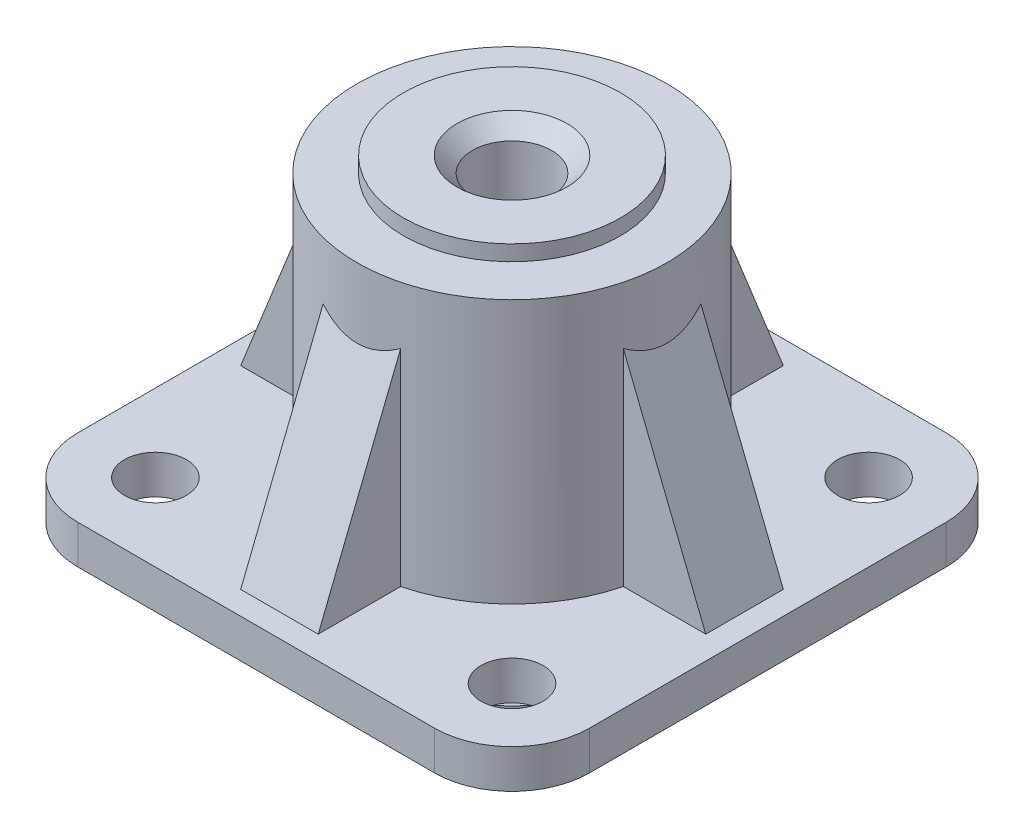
SolidWorks part; units mm, degrees
ref_plane "Front Plane" through (0, 0, 0) normal (0, 0, 1) x (1, 0, 0)
ref_plane "Top Plane" through (0, 0, 0) normal (0, 1, 0) x (1, 0, 0)
ref_plane "Right Plane" through (0, 0, 0) normal (1, 0, 0) x (0, 0, -1)
sketch "Sketch1" plane through (0, 0, 0) normal (0, 0, 1) x (1, 0, 0)
  line L0 (0, 0) -> (0, 56.7017) construction
  line L1 (0, 46) -> (14, 46)
  line L2 (14, 46) -> (14, 44)
  line L3 (14, 44) -> (20, 44)
  line L4 (20, 44) -> (20, 5)
  line L5 (20, 5) -> (29, 5)
  line L6 (29, 5) -> (29, 3)
  line L7 (29, 3) -> (18, 3)
  line L8 (18, 3) -> (18, 0)
  line L9 (18, 0) -> (15, 0)
  line L10 (15, 0) -> (15, 34)
  line L11 (10, 34) -> (10, 30)
  line L12 (10, 30) -> (0, 30)
  line L13 (10, 34) -> (15, 34)
  line L14 (0, 46) -> (0, 30)
  point P16 (29, 4)
  dimension "D1" = 46
  dimension "D2" = 14
  dimension "D3" = 2
  dimension "D4" = 6
  dimension "D5" = 39
  dimension "D6" = 9
  dimension "D7" = 2
  dimension "D8" = 11
  dimension "D9" = 3
  dimension "D10" = 34
  dimension "D11" = 5
  dimension "D12" = 4
revolve "Revolve1" add sketch "Sketch1" angle 360 about L0
sketch "Sketch2" plane through (0, 5, 0) normal (0, 1, 0) x (1, 0, 0)
  line L1 (-23, 33) -> (23, 33)
  line L2 (-33, 23) -> (-33, -23)
  line L3 (-23, -33) -> (23, -33)
  line L4 (33, 23) -> (33, -23)
  line L5 (-33, 33) -> (33, -33) construction
  line L6 (-33, -33) -> (33, 33) construction
  arc A0 (-33, -23) -> (-23, -33) centre (-23, -23) ccw
  arc A1 (23, -33) -> (33, -23) centre (23, -23) ccw
  arc A2 (23, 33) -> (33, 23) centre (23, 23) cw
  arc A3 (-23, 33) -> (-33, 23) centre (-23, 23) ccw
  circle A4 centre (-23, 23) radius 4
  circle A5 centre (23, 23) radius 4
  circle A6 centre (23, -23) radius 4
  circle A7 centre (-23, -23) radius 4
  point P0 (0, 0)
  dimension "D3" = 10
  dimension "D4" = 8
  dimension "D1" = 66
  dimension "D2" = 66
extrude "Boss-Extrude1" add sketch "Sketch2" along normal blind 5
hole_wizard "M12 Tapped Hole1" positions "Sketch3" profile "Sketch4" tap size "M12" standard "ISO"
sketch "Sketch3" plane through (0, 46, 0) normal (0, 1, 0) x (1, 0, 0)
  point P0 (0, 0)
sketch "Sketch4" plane through (0, 46, 0) normal (1, 0, 0) x (0, 0, 1)
  line L0 (0, 0) -> (0, 16)
  line L1 (0, 16) -> (5.1, 16)
  line L2 (5.1, 16) -> (5.1, 0)
  line L5 (5.1, 0) -> (0, 0)
  line L11 (0, -6.35) -> (0, 107.95) construction
  dimension "Thru Tap Drill Dia." = 10.2
  dimension "Thru Tap Drill Depth" = 16
chamfer "Chamfer1" distance 2 angle 45 1 edges at (0, 46, 5.1)
sketch "Sketch5" plane through (0, 0, 0) normal (0, 0, 1) x (1, 0, 0)
  line L0 (0, 0) -> (0, 49.0918) construction
  line L1 (-30, 10) -> (-18.49, 38.7771)
  line L2 (-23, 10) -> (-33, 10) construction
  line L3 (-23, 10) -> (23, 10) construction
  dimension "D1" = 30
  dimension "D2" = 68.2
  dimension "D3" = 11.51
rib "Rib1" sketch "Sketch5" sketch "Sketch5" thickness 10 extrusion direction parallel to sketch draft on no parameters "D1"=10
pattern_circular "CirPattern1" count 4 over 360 about axis through (0, 0, 0) along (0, 1, 0) of "Rib1"
sketch "Sketch6" plane through (0, 5, 0) normal (0, -1, 0) x (1, 0, 0)
  circle A0 centre (0, 0) radius 4.005
  dimension "D1" = 8.01
extrude "Cut-Extrude1" cut sketch "Sketch6" against normal up to next
